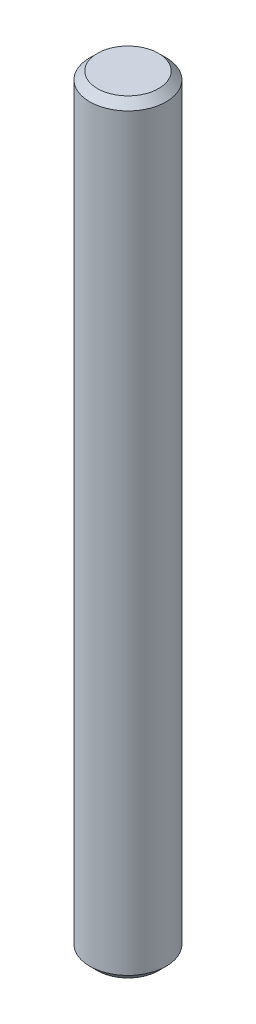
SolidWorks part; units mm, degrees
ref_plane "Front" through (0, 0, 0) normal (0, 0, 1) x (1, 0, 0)
ref_plane "Top" through (0, 0, 0) normal (0, 1, 0) x (1, 0, 0)
ref_plane "Right" through (0, 0, 0) normal (1, 0, 0) x (0, 0, -1)
sketch "Sketch1" plane through (0, 0, 0) normal (0, 1, 0) x (1, 0, 0)
  circle A0 centre (0, 0) radius 2
  dimension "D1" = 4
extrude "Extrude1" add sketch "Sketch1" along normal blind 40
chamfer "Chamfer1" distance 0.4 angle 45 2 edges at (0, 0, 2) (0, 40, 2)
